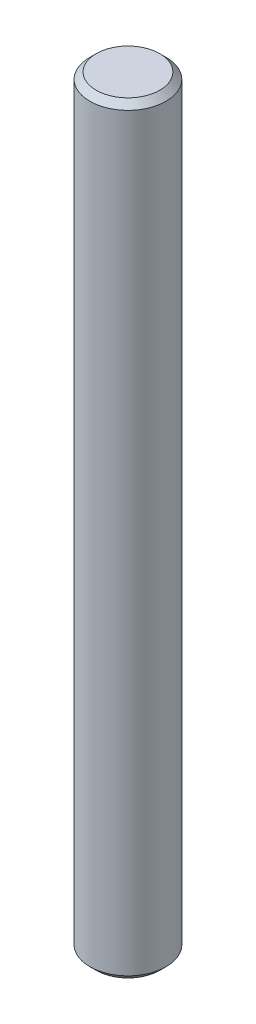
SolidWorks part; units mm, degrees
ref_plane "Спереди" through (0, 0, 0) normal (0, 0, 1) x (1, 0, 0)
ref_plane "Сверху" through (0, 0, 0) normal (0, 1, 0) x (1, 0, 0)
ref_plane "Справа" through (0, 0, 0) normal (1, 0, 0) x (0, 0, -1)
sketch "Эскиз1" plane through (0, 0, 0) normal (0, 1, 0) x (1, 0, 0)
  circle A0 centre (0, 0) radius 1.5
  dimension "D1" = 3
extrude "Бобышка-Вытянуть1" add sketch "Эскиз1" along normal mid plane 30
chamfer "Фаска1" distance 0.25 angle 45 2 edges at (0, -15, 1.5) (0, 15, 1.5)
